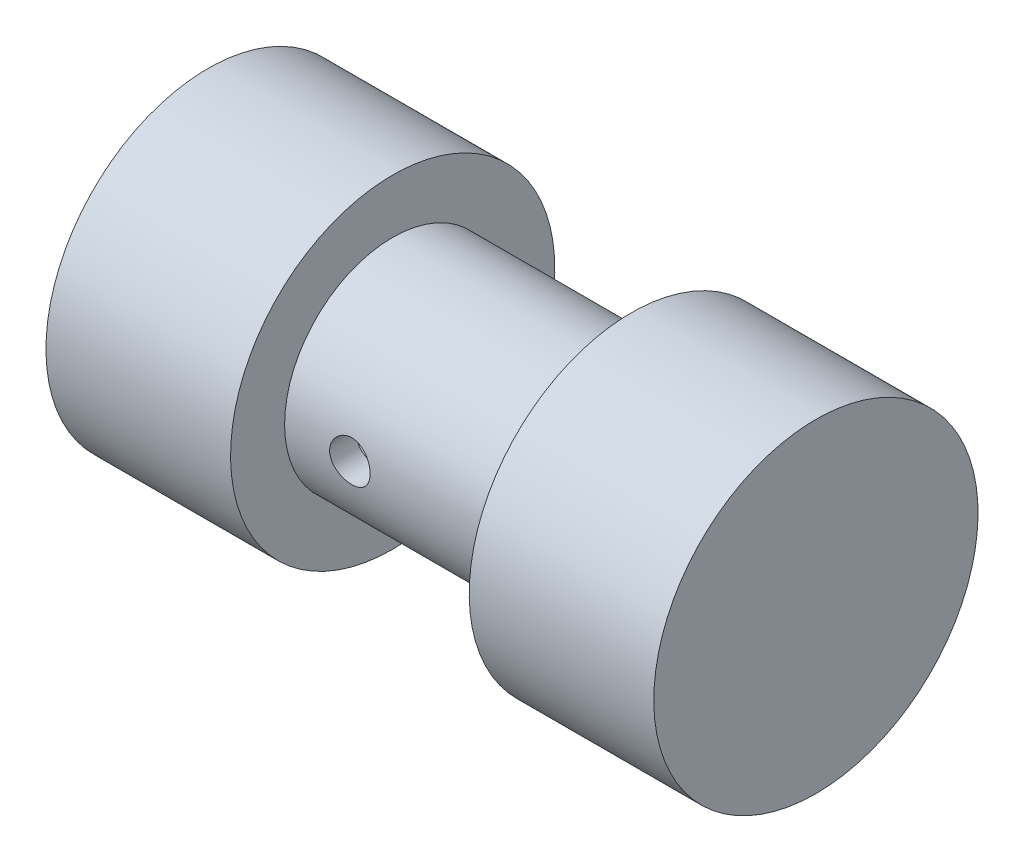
SolidWorks part; units mm, degrees
ref_plane "Front Plane" through (0, 0, 0) normal (0, 0, 1) x (1, 0, 0)
ref_plane "Top Plane" through (0, 0, 0) normal (0, 1, 0) x (1, 0, 0)
ref_plane "Right Plane" through (0, 0, 0) normal (1, 0, 0) x (0, 0, -1)
sketch "Sketch1" plane through (0, 0, 0) normal (0, 0, 1) x (1, 0, 0)
  line L0 (0, 0) -> (33.9655, 0) construction
  line L1 (0, 0) -> (0, 24.1996) construction
  line L2 (17.8562, 0) -> (17.8562, 9.525)
  line L3 (17.8562, 9.525) -> (7.0104, 9.525)
  line L4 (7.0104, 9.525) -> (7.0104, 6.35)
  line L5 (7.0104, 6.35) -> (-7.0104, 6.35)
  line L6 (-7.0104, 6.35) -> (-7.0104, 9.525)
  line L7 (-7.0104, 9.525) -> (-17.8562, 9.525)
  line L8 (-17.8562, 9.525) -> (-17.8562, 4.7625)
  line L9 (-17.8562, 4.7625) -> (1.1938, 4.7625)
  line L10 (1.1938, 4.7625) -> (1.1938, 0)
  line L11 (12.7, 2.4774) -> (12.7, 24.3302) construction
  line L12 (-12.7, -2.5455) -> (-12.7, 24.0041) construction
  line L14 (17.8562, 0) -> (1.1938, 0)
  dimension "D1" = 5.6896
  dimension "D2" = 5.1562
  dimension "D3" = 19.05
  dimension "D4" = 12.7
  dimension "D5" = 9.525
  dimension "D6" = 19.05
  dimension "D7" = 12.7
  dimension "D8" = 12.7
revolve "Revolve1" add sketch "Sketch1" angle 360 about L0
sketch "Sketch2" plane through (0, 0, 0) normal (0, 0, 1) x (1, 0, 0)
  circle A0 centre (-3.175, 0) radius 1.1906
  dimension "D1" = 2.3813
  dimension "D2" = 3.175
extrude "Cut-Extrude1" cut sketch "Sketch2" against normal through all and the other way through all
